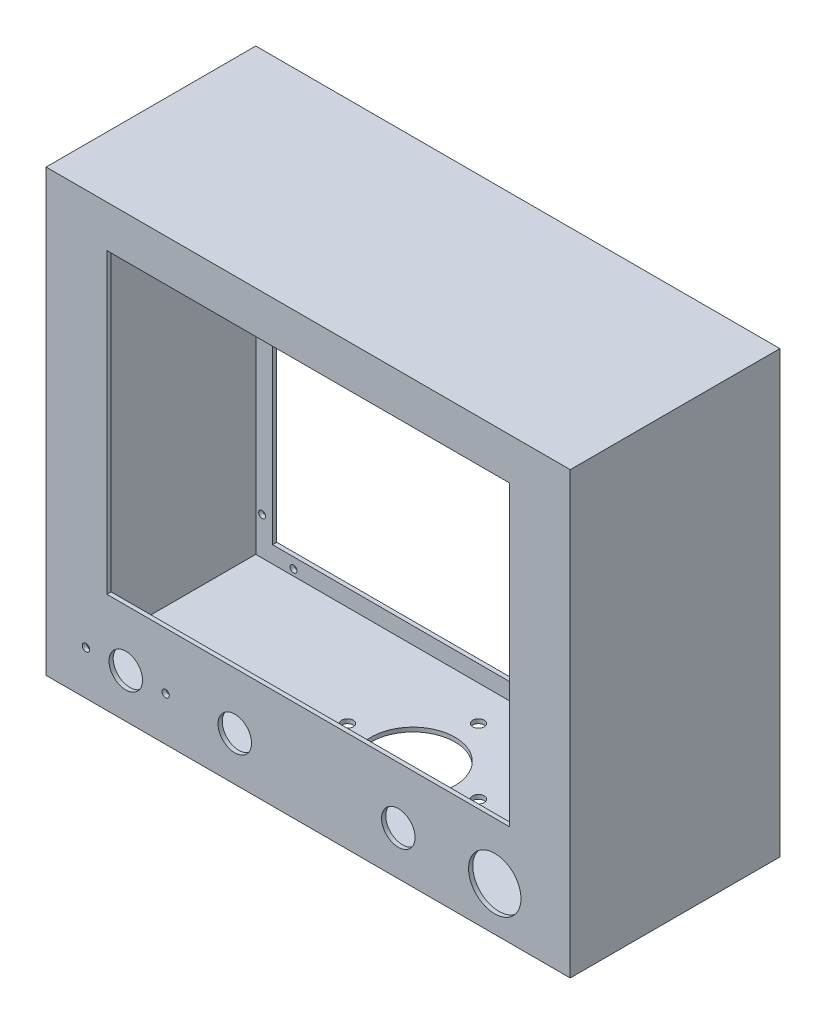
SolidWorks part; units mm, degrees
ref_plane "前视基准面" through (0, 0, 0) normal (0, 0, 1) x (1, 0, 0)
ref_plane "上视基准面" through (0, 0, 0) normal (0, 1, 0) x (1, 0, 0)
ref_plane "右视基准面" through (0, 0, 0) normal (1, 0, 0) x (0, 0, -1)
sketch "草图1" plane through (0, 0, 0) normal (0, 0, 1) x (1, 0, 0)
  line L0 (0, 210) -> (250, 210)
  line L1 (250, 0) -> (250, 210)
  line L2 (0, 0) -> (0, 210)
  line L3 (0, 0) -> (250, 0)
extrude "凸台-拉伸1" add sketch "草图1" along normal blind 100
shell "抽壳1" thickness 2
sketch "草图2" plane through (0, 0, 100) normal (0, 0, 1) x (1, 0, 0)
  line L0 (29, 48) -> (221, 48)
  line L1 (29, 190) -> (221, 190)
  line L2 (221, 48) -> (221, 190)
  line L3 (29, 48) -> (29, 190)
extrude "切除-拉伸1" cut sketch "草图2" against normal blind 2
sketch "草图3" plane through (0, 0, 100) normal (0, 0, 1) x (1, 0, 0)
  circle A0 centre (19, 21) radius 1.75
  circle A1 centre (57, 21) radius 1.75
  circle A2 centre (90, 21) radius 8
  circle A5 centre (168, 21) radius 8
  circle A6 centre (38, 21) radius 8
  circle A7 centre (214, 21) radius 12.5
  dimension "D1" = 16
extrude "切除-拉伸2" cut sketch "草图3" against normal blind 2
sketch "草图4" plane through (0, 0, 2) normal (0, 0, 1) x (1, 0, 0)
  line L0 (10, 10) -> (10, 200)
  line L1 (240, 10) -> (240, 200)
  line L2 (10, 200) -> (240, 200)
  line L3 (10, 10) -> (240, 10)
extrude "切除-拉伸3" cut sketch "草图4" against normal blind 2
sketch "草图5" plane through (0, 0, 2) normal (0, 0, 1) x (1, 0, 0)
  circle A0 centre (20, 205) radius 1.65
  circle A1 centre (230, 205) radius 1.65
  circle A2 centre (245, 190) radius 1.65
  circle A3 centre (245, 20) radius 1.65
  circle A4 centre (230, 5) radius 1.65
  circle A5 centre (20, 5) radius 1.65
  circle A6 centre (5, 20) radius 1.65
  circle A7 centre (5, 190) radius 1.65
extrude "切除-拉伸4" cut sketch "草图5" against normal blind 2
sketch "草图8" plane through (0, 2, 0) normal (0, 1, 0) x (1, 0, 0)
  circle A0 centre (125, -50) radius 20
  circle A1 centre (125, -81.25) radius 2.75
  circle A2 centre (156.25, -50) radius 2.75
  circle A3 centre (125, -18.75) radius 2.75
  circle A4 centre (93.75, -50) radius 2.75
extrude "切除-拉伸5" cut sketch "草图8" against normal blind 2
